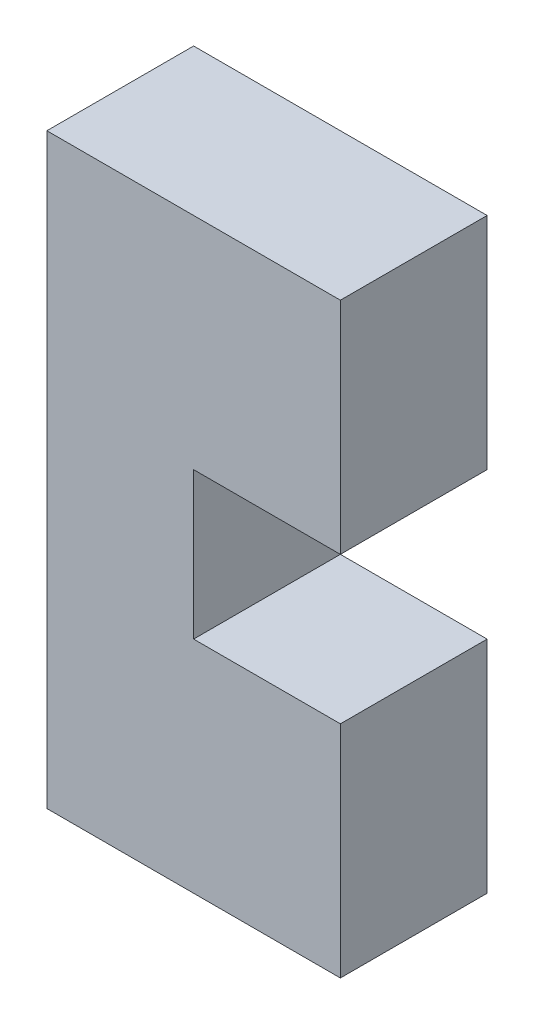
SolidWorks part; units mm, degrees
ref_plane "Plan de face" through (0, 0, 0) normal (0, 0, 1) x (1, 0, 0)
ref_plane "Plan de dessus" through (0, 0, 0) normal (0, 1, 0) x (1, 0, 0)
ref_plane "Plan de droite" through (0, 0, 0) normal (1, 0, 0) x (0, 0, -1)
sketch "Esquisse1" plane through (0, 0, 0) normal (0, 0, 1) x (1, 0, 0)
  line L0 (-5, 10) -> (5, 10)
  line L1 (5, 10) -> (5, 2.5)
  line L2 (5, 2.5) -> (0, 2.5)
  line L3 (0, 2.5) -> (0, -2.5)
  line L4 (0, -2.5) -> (5, -2.5)
  line L5 (5, -2.5) -> (5, -10)
  line L6 (5, -10) -> (-5, -10)
  line L7 (-5, -10) -> (-5, 10)
  point P11 (-2.4723, 11.7033)
  dimension "D1" = 5
  dimension "D2" = 5
  dimension "D3" = 5
  dimension "D4" = 20
  dimension "D5" = 7.5
  dimension "D6" = 5
  dimension "D7" = 10
extrude "Boss.-Extru.1" add sketch "Esquisse1" along normal blind 5
